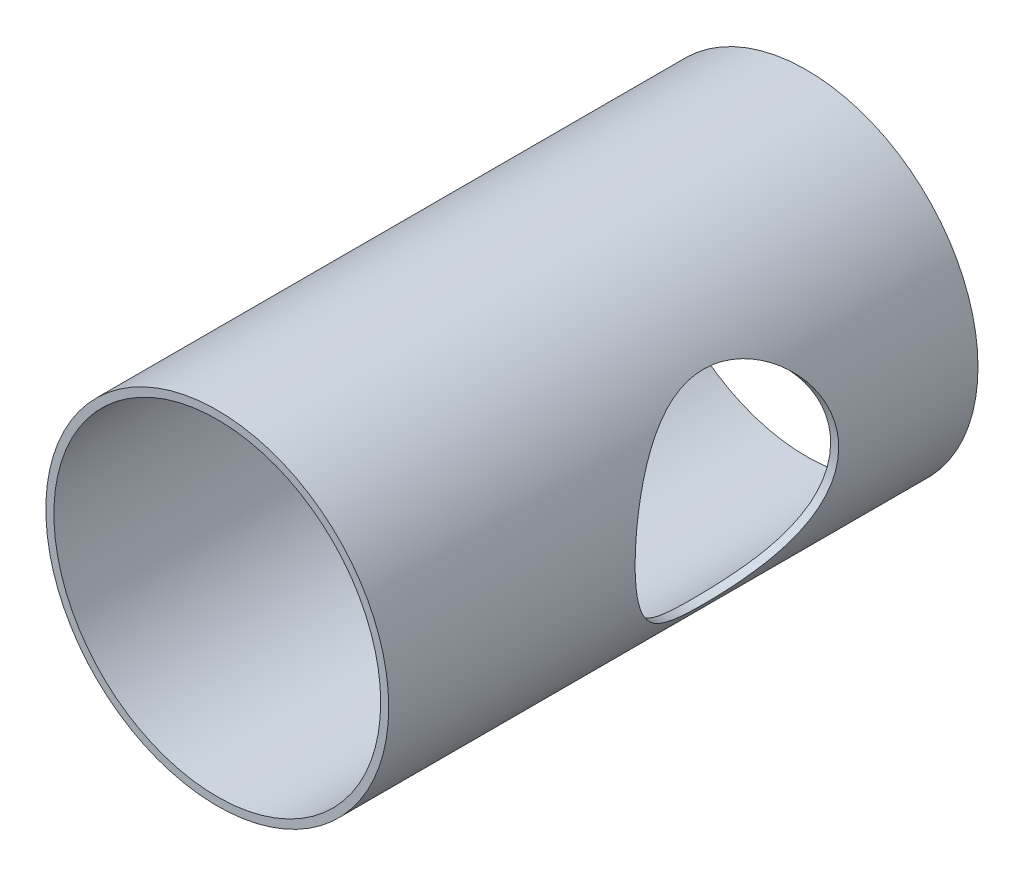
SolidWorks part; units mm, degrees
ref_plane "Plan de face" through (0, 0, 0) normal (0, 0, 1) x (1, 0, 0)
ref_plane "Plan de dessus" through (0, 0, 0) normal (0, 1, 0) x (1, 0, 0)
ref_plane "Plan de droite" through (0, 0, 0) normal (1, 0, 0) x (0, 0, -1)
sketch "Esquisse1" plane through (0, 0, 0) normal (0, 0, 1) x (1, 0, 0)
  circle A0 centre (0, 0) radius 64
  circle A1 centre (0, 0) radius 61
  dimension "D1" = 128
  dimension "D2" = 122
extrude "Extrusion1" add sketch "Esquisse1" along normal blind 220
sketch "Esquisse2" plane through (0, 0, 0) normal (1, 0, 0) x (0, 0, -1)
  line L1 (0, -64) -> (0, 64) construction
  circle A0 centre (-90, 0) radius 38
  dimension "D1" = 76
  dimension "D2" = 90
extrude "Extrusion2" cut sketch "Esquisse2" against normal through all and the other way through all
